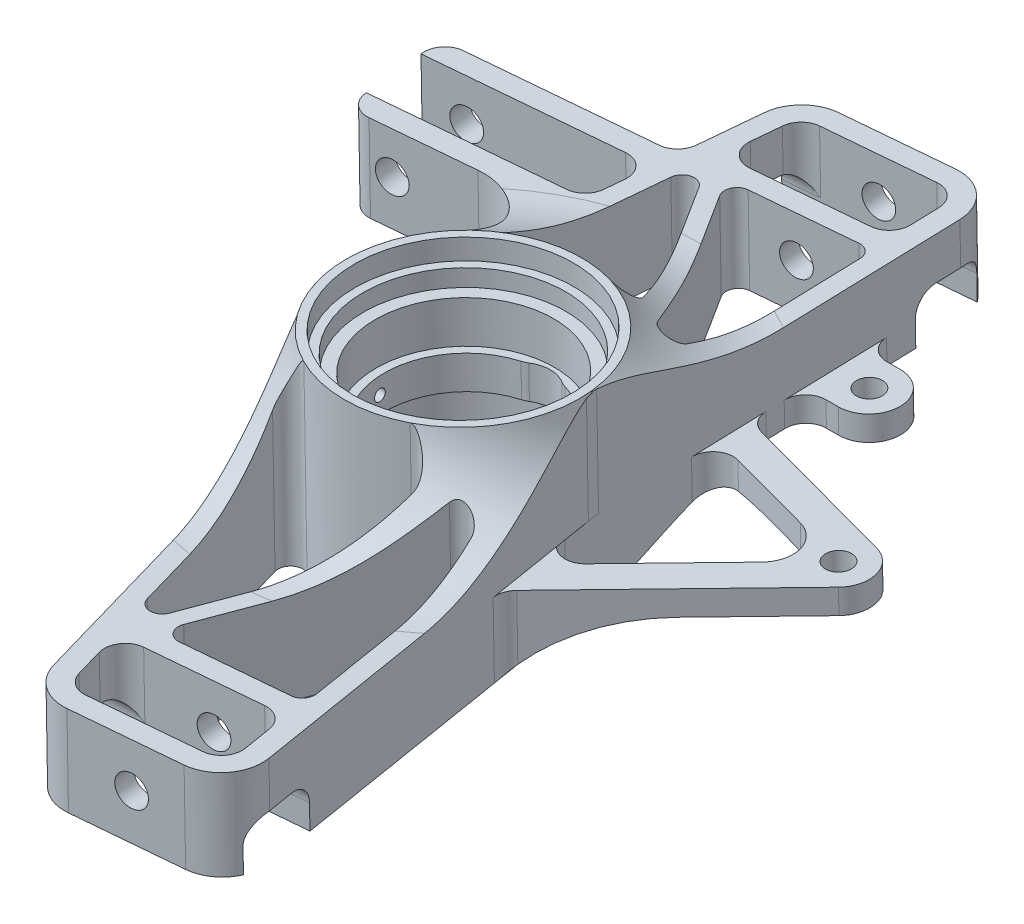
SolidWorks part; units mm, degrees
other "<Upright>-<Cut-Extrude21>"
ref_plane "Front Plane" through (0, 0, 0) normal (0, 0, 1) x (1, 0, 0)
ref_plane "Top Plane" through (0, 0, 0) normal (0, 1, 0) x (1, 0, 0)
ref_plane "Right Plane" through (0, 0, 0) normal (1, 0, 0) x (0, 0, -1)
mirrored part "Upright_Mirrored"
sketch3d "3DSketch1"
  point P1 (0, -588.0329, 254)
  point P2 (6.0071, -585.1881, 142.875)
  point P3 (25.6413, -565.9628, 365.9505)
  point P4 (-78.74, -584.2, 182.88)
  point P5 (-78.74, 584.2, 182.88)
  point P6 (0, 588.0329, 254)
  point P9 (6.0071, 585.1881, 142.875)
  point P10 (25.6413, 565.9628, 365.9505)
